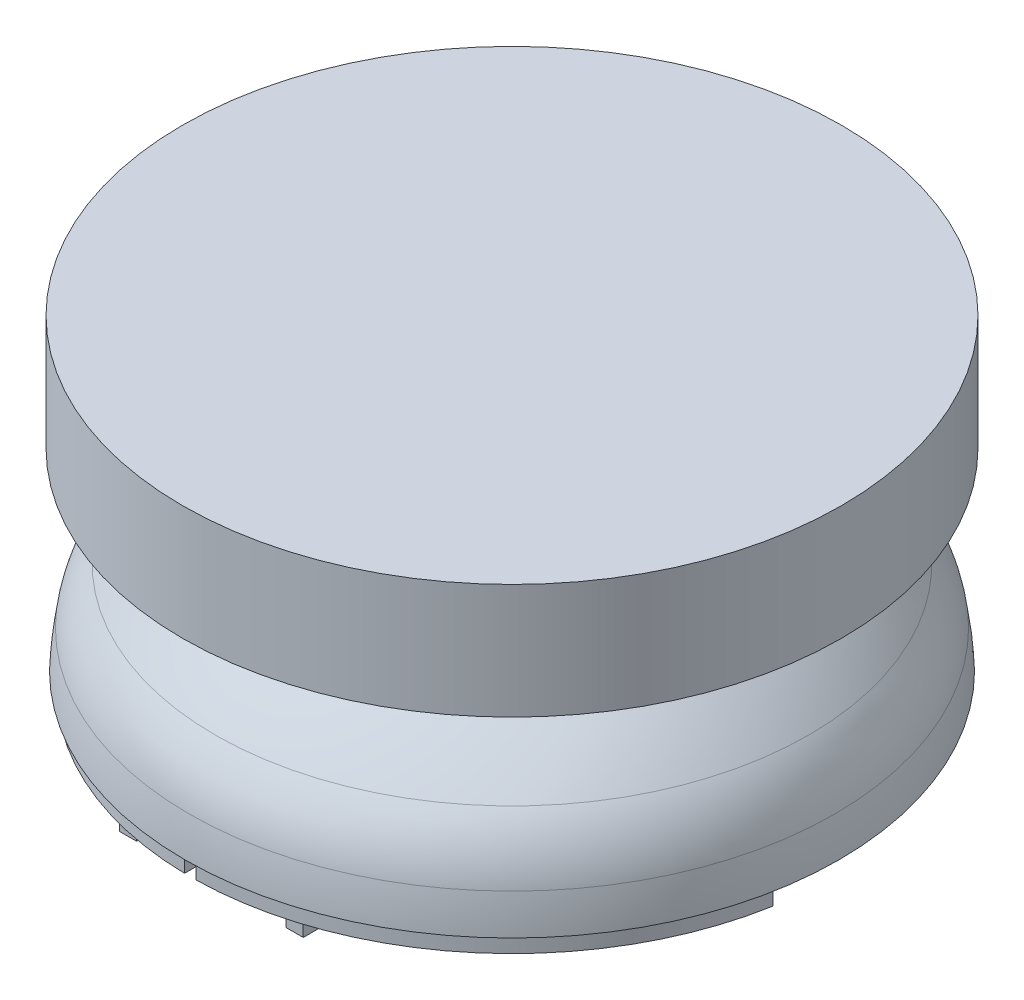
SolidWorks part; units mm, degrees
ref_plane "Plan de face" through (0, 0, 0) normal (0, 0, 1) x (1, 0, 0)
ref_plane "Plan de dessus" through (0, 0, 0) normal (0, 1, 0) x (1, 0, 0)
ref_plane "Plan de droite" through (0, 0, 0) normal (1, 0, 0) x (0, 0, -1)
sketch "Esquisse1" plane through (0, 0, 0) normal (0, 0, 1) x (1, 0, 0)
  line L0 (0, 0) -> (0, 21.5) construction
  line L1 (0, 0) -> (-28.5, 0) construction
  line L2 (-28.5, 21.5) -> (0, 21.5) construction
  line L3 (-28.5, 21.5) -> (-28.5, 0) construction
  arc A0 (0, 21.5) -> (-25.8378, 9.6) centre (0, -12.5) ccw
  arc A1 (-28.5, 0) -> (-28.097, 4.7757) centre (0, 0) cw
  arc A2 (-25.8378, 9.6) -> (-28.097, 4.7757) centre (-18.2384, 3.1) ccw
  point P4 (0, -12.5)
  dimension "D2" = 28.5
  dimension "D3" = 34
  dimension "D4" = 10
  dimension "D1" = 12.5
  dimension "D5" = 21.5
  dimension "D6" = 28.5
revolve "Révol.-Mince1" add sketch "Esquisse1" angle 360 about L0
ref_plane "Plan1" through (0, 18.3, 0) normal (0, 1, 0) x (-1, 0, 0)
sketch "Esquisse3" plane through (0, 18.3, 0) normal (0, 1, 0) x (-1, 0, 0)
  circle A0 centre (0, 0) radius 28.6744
extrude "Extrusion2" add sketch "Esquisse3" along normal blind 10 separate body
sketch "Esquisse5" plane through (0, 18.3, 0) normal (0, -1, 0) x (1, 0, 0)
  circle A0 centre (0, 6) radius 10.1
  dimension "D1" = 20.2
  dimension "D2" = 6
extrude "Extrusion3" add sketch "Esquisse5" along normal blind 1
other "Embouti2" parameters "D1"=1.5, "D2"=0
fillet "Congé7" radius 2 2 edges at (-0.4808, 17.4487, 16.0886) (0, 18.3, -14.4)
sketch "Esquisse6" plane through (0, 0, 0) normal (1, 0, 0) x (0, 0, -1)
  line L0 (0, 0) -> (0, 12.5248) construction
  line L1 (28.5, 0) -> (26.5, 0)
  line L2 (28.5, 0) -> (28.5, 1.5)
  line L3 (28.5, 1.5) -> (26.5, 1.5)
  line L4 (26.5, 0) -> (26.5, 1.5)
  line L5 (-28.5, 0) -> (28.5, 0) construction
  dimension "D1" = 2
  dimension "D2" = 1.5
revolve "Enlèvement de matière-Révolution1" cut sketch "Esquisse6" angle 200 about L0
sketch "Esquisse7" plane through (0, 0, 0) normal (1, 0, 0) x (0, 0, -1)
  line L0 (0, 0) -> (0, 12.5374) construction
  line L1 (-28.5, 0) -> (-28, 0)
  line L2 (-28.5, 0) -> (-28.5, 1.5)
  line L3 (-28.5, 1.5) -> (-28, 1.5)
  line L4 (-28, 0) -> (-28, 1.5)
  dimension "D1" = 0.5
  dimension "D2" = 1.5
revolve "Enlèvement de matière-Révolution2" cut sketch "Esquisse7" angle 360 about L0
sketch "Esquisse8" plane through (0, 0, 0) normal (1, 0, 0) x (0, 0, -1)
  line L0 (-28, 0) -> (-4.8621, 0) construction
  line L1 (-28, 0) -> (-26.5, 0)
  line L2 (-28, 0) -> (-28, 1.5)
  line L3 (-28, 1.5) -> (-26.5, 1.5)
  line L4 (-26.5, 0) -> (-26.5, 1.5)
  line L5 (-28, 1.5) -> (-4.8621, 1.5) construction
  dimension "D1" = 1.5
extrude "Enlèv. mat.-Extru.2" cut sketch "Esquisse8" against normal mid plane 1
ref_plane "Plan2" through (6.5, 0, 0) normal (1, 0, 0) x (0, 0, -1)
sketch "Esquisse9" plane through (6.5, 0, 0) normal (1, 0, 0) x (0, 0, -1)
  line L0 (-26.1666, 0) -> (-26.1666, -1.5)
  line L2 (-22.1666, -1.5) -> (-20.6666, -1.5)
  line L3 (-20.6666, -1.5) -> (-20.6666, 12.4576)
  line L4 (-24.1666, -0.5) -> (-24.1666, -1.5)
  line L5 (-22.1666, -0.5) -> (-22.1666, -1.5)
  line L6 (-24.1666, -1.5) -> (-26.1666, -1.5)
  line L7 (-26.1666, 0) -> (-26.4601, 4.3358)
  line L9 (-26.9954, 0) -> (-4.6885, 0) construction
  line L10 (-26.4601, 4.3358) -> (-25.6196, 7.8628)
  line L11 (-25.6196, 7.8628) -> (-20.6666, 12.4576)
  arc A0 (-22.1666, -0.5) -> (-24.1666, -0.5) centre (-23.1666, -0.5) ccw
  dimension "D3" = 2
  dimension "D1" = 5.5
  dimension "D2" = 1.5
  dimension "D5" = 1
extrude "Extrusion4" add sketch "Esquisse9" along normal blind 1.5
mirror "Symétrie1" about plane through (0, 0, 0) normal (1, 0, 0) of "Extrusion4"
sketch "Esquisse11" plane through (0, 0, 0) normal (0, 0, 1) x (1, 0, 0)
  line L0 (-17.5, 0) -> (-17.5, 21.1145) construction
  line L1 (-27.5746, 0) -> (-0.5, 0) construction
  line L2 (-17.5, 1.5) -> (-14.5, 1.5)
  line L3 (-27.5746, 1.5) -> (-0.5, 1.5) construction
  line L4 (-14.5, 1.5) -> (-14, 19.161)
  line L5 (-14, 19.161) -> (-17.5, 19.161)
  line L6 (-17.5, 19.161) -> (-17.5, 1.5)
  dimension "D1" = 17.5
  dimension "D2" = 3
  dimension "D3" = 3.5
revolve "Révolution1" add sketch "Esquisse11" angle 360 about L6
pattern_linear "Répétition linéaire4" count 2 spacing 35 along (1, 0, 0)
other "Embouti3" parameters "D1"=1, "D2"=0
sketch "Esquisse12" plane through (0, 0.5, 0) normal (0, -1, 0) x (1, 0, 0)
  circle A0 centre (-17.5, 0) radius 1.5
  dimension "D1" = 3
extrude "Enlèv. mat.-Extru.3" cut sketch "Esquisse12" against normal up to next
mirror "Symétrie4" about plane through (0, 0, 0) normal (1, 0, 0) of "Enlèv. mat.-Extru.3"
sketch "Esquisse15" plane through (0, 0, 0) normal (1, 0, 0) x (0, 0, -1)
  line L0 (9.9605, 1.5) -> (9.9605, 21.3197) construction
  line L1 (-28.4605, 1.5) -> (28.4605, 1.5) construction
  line L2 (9.9605, 5) -> (13.4605, 5)
  line L3 (13.4605, 5) -> (13.9605, 18.3)
  line L4 (13.9605, 18.3) -> (9.9605, 18.3)
  line L5 (9.9605, 18.3) -> (9.9605, 5)
  line L7 (13.9485, 18.3) -> (-10.7125, 18.3) construction
  dimension "D1" = 3.5
  dimension "D2" = 3.5
  dimension "D3" = 4
  dimension "D4" = 18.5
revolve "Révolution2" add sketch "Esquisse15" angle 360 about L0
other "Embouti4" parameters "D1"=1, "D2"=0
sketch "Esquisse16" plane through (0, 1.5, 0) normal (0, -1, 0) x (1, 0, 0)
  line L0 (-0.65, -9.9991) -> (0.65, -9.9991)
  line L1 (3.65, -9.9991) -> (3.65, -27.5089)
  line L2 (0.65, -9.9991) -> (0.65, -27.617)
  line L3 (0, 0) -> (0, -27.75) construction
  line L4 (3.65, -9.9991) -> (4.95, -9.9991)
  line L5 (4.95, -9.9991) -> (4.95, -27.3049)
  line L6 (7.95, -26.5868) -> (7.95, -9.9991)
  line L7 (7.95, -9.9991) -> (9.25, -9.9991)
  line L8 (9.25, -9.9991) -> (9.25, -26.163)
  line L9 (12.25, -24.8998) -> (12.25, -9.9991)
  line L10 (12.25, -9.9991) -> (13.55, -9.9991)
  line L11 (13.55, -9.9991) -> (13.55, -24.2169)
  line L12 (0.65, -27.617) -> (-0.65, -27.617)
  line L13 (-3.65, -9.9991) -> (-3.65, -27.5089)
  line L14 (-3.65, -9.9991) -> (-4.95, -9.9991)
  line L15 (-4.95, -9.9991) -> (-4.95, -27.3049)
  line L16 (-7.95, -26.5868) -> (-7.95, -9.9991)
  line L17 (-7.95, -9.9991) -> (-9.25, -9.9991)
  line L18 (-9.25, -9.9991) -> (-9.25, -26.163)
  line L19 (-12.25, -9.9991) -> (-13.55, -9.9991)
  line L20 (-13.55, -9.9991) -> (-13.55, -24.2169)
  line L21 (-12.25, -24.8998) -> (-12.25, -9.9991)
  line L22 (-0.65, -9.9991) -> (-0.65, -27.617)
  arc A0 (12.25, -24.8998) -> (13.55, -24.2169) centre (0, 0) ccw
  arc A2 (-3.65, -27.5089) -> (-4.95, -27.3049) centre (0, 0) cw
  arc A3 (7.95, -26.5868) -> (9.25, -26.163) centre (0, 0) ccw
  arc A4 (-7.95, -26.5868) -> (-9.25, -26.163) centre (0, 0) cw
  arc A5 (3.65, -27.5089) -> (4.95, -27.3049) centre (0, 0) ccw
  arc A6 (-12.25, -24.8998) -> (-13.55, -24.2169) centre (0, 0) cw
  dimension "D1" = 1.3
  dimension "D2" = 1.3
  dimension "D3" = 1.3
  dimension "D4" = 1.3
  dimension "D5" = 0.65
  dimension "D7" = 3
  dimension "D8" = 3
extrude "Extrusion5" add sketch "Esquisse16" against normal up to body separate body
